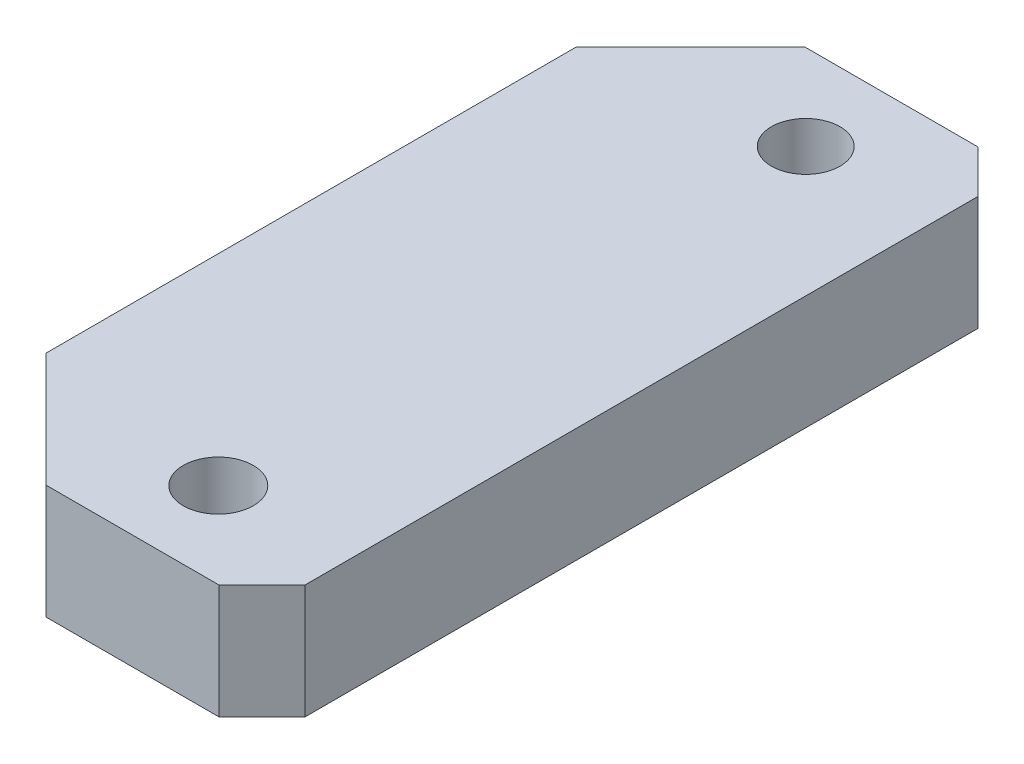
SolidWorks part; units mm, degrees
ref_plane "Front Plane" through (0, 0, 0) normal (0, 0, 1) x (1, 0, 0)
ref_plane "Top Plane" through (0, 0, 0) normal (0, 1, 0) x (1, 0, 0)
ref_plane "Right Plane" through (0, 0, 0) normal (1, 0, 0) x (0, 0, -1)
sketch "Sketch7" plane through (0, 0, 0) normal (0, 1, 0) x (-1, 0, 0)
  line L2 (37.72, 13.28) -> (43.78, 13.28)
  line L9 (37.72, 13.28) -> (36.22, 11.78)
  line L16 (43.78, 13.28) -> (47.78, 9.28)
  line L18 (47.78, 9.28) -> (47.78, -9.28)
  line L19 (47.78, -9.28) -> (43.78, -13.28)
  line L20 (36.22, -11.78) -> (37.72, -13.28)
  line L21 (36.22, 11.78) -> (36.22, -11.78)
  line L22 (37.72, -13.28) -> (43.78, -13.28)
  circle A4 centre (40.75, 10.28) radius 1.2255
  circle A5 centre (40.75, -10.28) radius 1.2
extrude "Boss-Extrude5" add sketch "Sketch7" against normal blind 4
